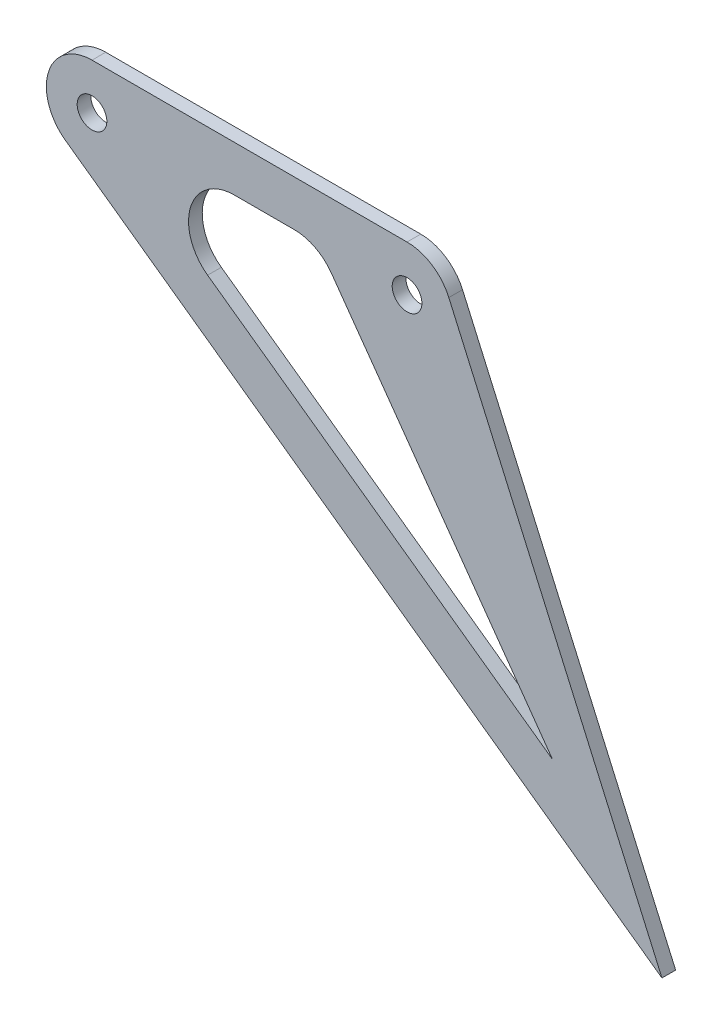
SolidWorks part; units mm, degrees
ref_plane "Front Plane" through (0, 0, 0) normal (0, 0, 1) x (1, 0, 0)
ref_plane "Top Plane" through (0, 0, 0) normal (0, 1, 0) x (1, 0, 0)
ref_plane "Right Plane" through (0, 0, 0) normal (1, 0, 0) x (0, 0, -1)
sketch "Sketch1" plane through (0, 0, 0) normal (0, 0, 1) x (1, 0, 0)
  line L0 (0, 0) -> (69, 0) construction
  line L1 (69, 0) -> (124.8261, -101.6831) construction
  line L2 (124.8261, -101.6831) -> (0, 0) construction
  line L3 (0, 10) -> (69, 10)
  line L4 (100.9, -72.2511) -> (25.3196, -18.1305)
  line L5 (31.1415, 0) -> (44.2961, 0)
  line L6 (52.4419, -4.1995) -> (100.9, -72.2511)
  line L7 (124.8261, -101.6831) -> (78.148, 4.039)
  line L8 (124.8261, -101.6831) -> (-5.822, -8.1305)
  line L9 (100.9, -72.2511) -> (0, 0) construction
  line L10 (0, 0) -> (69, 0) construction
  line L11 (100.9, -72.2511) -> (69, 0) construction
  circle A0 centre (69, 0) radius 3.25
  circle A1 centre (0, 0) radius 3.25
  arc A2 (52.4419, -4.1995) -> (44.2961, 0) centre (44.2961, -10) ccw
  arc A3 (78.148, 4.039) -> (69, 10) centre (69, 0) ccw
  arc A5 (0, 10) -> (-5.822, -8.1305) centre (0, 0) ccw
  arc A6 (25.3196, -18.1305) -> (31.1415, 0) centre (31.1415, -10) cw
  arc A7 (0, 0) -> (0, 0) centre (0, 0) ccw construction
  arc A8 (69, 0) -> (69, 0) centre (69, 0) ccw construction
  dimension "D4" = 6.5
  dimension "D7" = 10
  dimension "D8" = 10
  dimension "D1" = 69
  dimension "D2" = 116
  dimension "D3" = 161
  dimension "D5" = 10
  dimension "D6" = 10
extrude "Extrude1" add sketch "Sketch1" along normal blind 3
